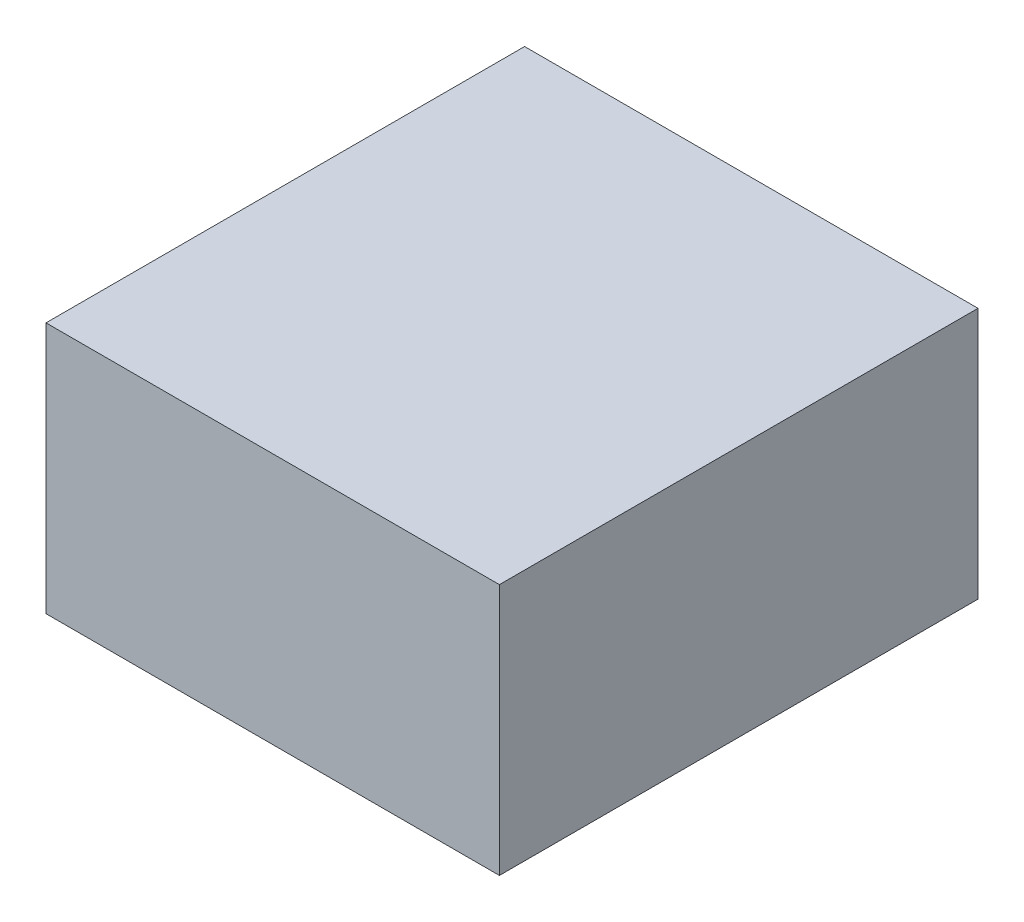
SolidWorks part; units mm, degrees
ref_plane "Front Plane" through (0, 0, 0) normal (0, 0, 1) x (1, 0, 0)
ref_plane "Top Plane" through (0, 0, 0) normal (0, 1, 0) x (1, 0, 0)
ref_plane "Right Plane" through (0, 0, 0) normal (1, 0, 0) x (0, 0, -1)
sketch "Sketch1" plane through (0, 0, 0) normal (0, 0, 1) x (1, 0, 0)
  line L1 (-45, 25) -> (45, 25)
  line L2 (-45, 25) -> (-45, -25)
  line L3 (-45, -25) -> (45, -25)
  line L4 (45, 25) -> (45, -25)
  line L5 (-45, 25) -> (45, -25) construction
  line L6 (-45, -25) -> (45, 25) construction
  point P0 (0, 0)
  dimension "D1" = 90
  dimension "D2" = 50
extrude "Boss-Extrude1" add sketch "Sketch1" along normal blind 95
